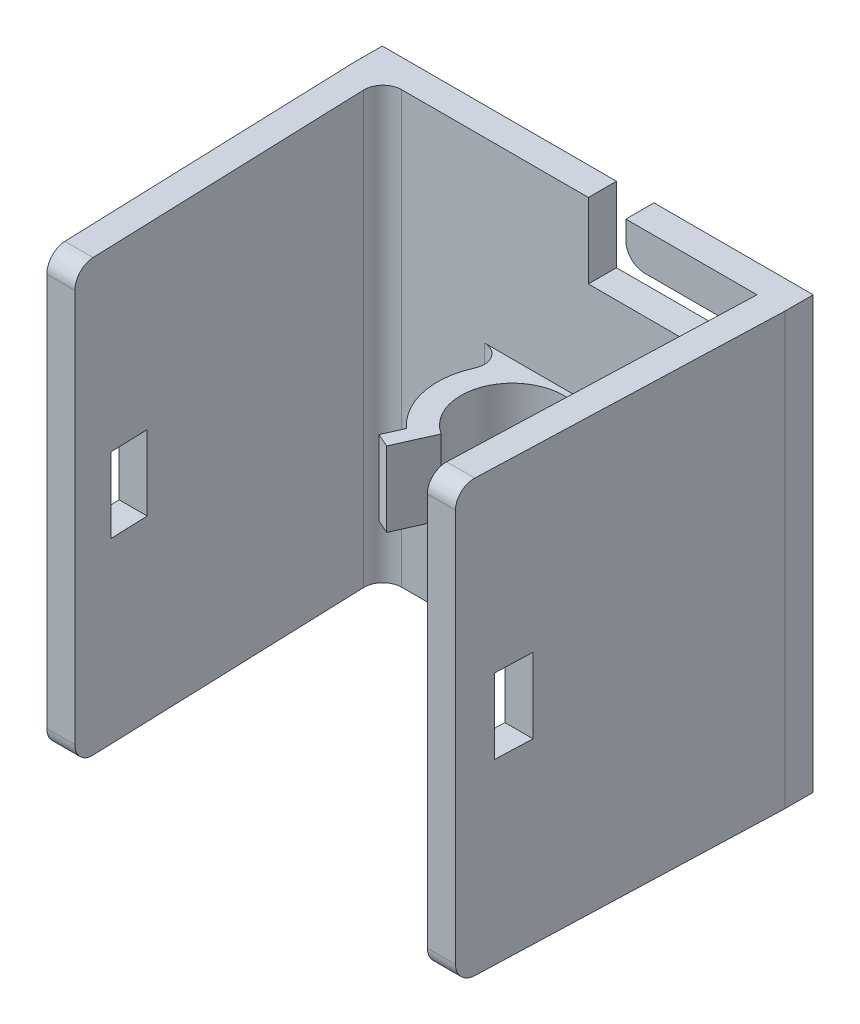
SolidWorks part; units mm, degrees
ref_plane "Plan de face" through (0, 0, 0) normal (0, 0, 1) x (1, 0, 0)
ref_plane "Plan de dessus" through (0, 0, 0) normal (0, 1, 0) x (1, 0, 0)
ref_plane "Plan de droite" through (0, 0, 0) normal (1, 0, 0) x (0, 0, -1)
sketch "Esquisse1" plane through (0, 0, 0) normal (0, 0, 1) x (1, 0, 0)
  line L1 (-24.8932, 11.4129) -> (-1.8932, 11.4129)
  line L2 (-24.8932, 11.4129) -> (-24.8932, -11.5871)
  line L3 (-24.8932, -11.5871) -> (-1.8932, -11.5871)
  line L4 (-1.8932, 11.4129) -> (-1.8932, -11.5871)
  dimension "D1" = 23
  dimension "D2" = 23
extrude "Boss.-Extru.1" add sketch "Esquisse1" along normal blind 1.5
sketch "Esquisse2" plane through (0, -11.5871, 0) normal (0, -1, 0) x (1, 0, 0)
  line L0 (-24.8932, 1.5) -> (-24.2996, 18.5)
  line L1 (-24.2996, 18.5) -> (-22.7996, 18.5)
  line L2 (-22.7996, 18.5) -> (-23.3932, 1.5)
  line L3 (-24.8932, 1.5) -> (-1.8932, 1.5) construction
  line L4 (-23.3932, 1.5) -> (-24.8932, 1.5)
  line L5 (-13.3932, 1.5) -> (-13.3932, 31.4427) construction
  line L6 (-3.3932, 1.5) -> (-1.8932, 1.5)
  line L7 (-3.9869, 18.5) -> (-3.3932, 1.5)
  line L8 (-2.4869, 18.5) -> (-3.9869, 18.5)
  line L9 (-1.8932, 1.5) -> (-2.4869, 18.5)
  dimension "D1" = 1.5
  dimension "D2" = 88
  dimension "D3" = 17
extrude "Boss.-Extru.2" add sketch "Esquisse2" against normal blind 23
sketch "Esquisse3" plane through (0, 0, 0) normal (1, 0, 0) x (0, 0, -1)
  line L0 (-1.5, -0.0871) -> (-22.1057, -0.0871) construction
  line L1 (-16.5, 1.9129) -> (-14.5, 1.9129)
  line L2 (-16.5, 1.9129) -> (-16.5, -2.0871)
  line L3 (-16.5, -2.0871) -> (-14.5, -2.0871)
  line L4 (-14.5, 1.9129) -> (-14.5, -2.0871)
  line L5 (-1.5, -11.5871) -> (-1.5, 11.4129) construction
  line L6 (-18.5, 11.4129) -> (-18.5, -11.5871) construction
  dimension "D1" = 2
  dimension "D2" = 2
  dimension "D3" = 2
  dimension "D4" = 2
extrude "Enlèv. mat.-Extru.1" cut sketch "Esquisse3" against normal through all both and the other way through all
ref_plane "Plan1" through (-13.3932, 0, 0) normal (-1, 0, 0) x (0, 0, 1)
ref_plane "Plan2" through (0, -0.0871, 0) normal (0, 1, 0) x (1, 0, 0)
sketch "Esquisse6" plane through (0, -0.0871, 0) normal (0, 1, 0) x (1, 0, 0)
  line L0 (-13.3932, 0) -> (-13.3932, -14.3157) construction
  line L2 (-1.8932, 0) -> (-24.8932, 0) construction
  line L3 (-13.3932, 0.825) -> (-13.3932, -0.825) construction
  circle A0 centre (-13.3932, -4.5572) radius 4
  circle A1 centre (-13.3932, -4.5572) radius 2.75
  point P8 (-13.3932, -4.5572)
  dimension "D1" = 8
  dimension "D2" = 5.5
extrude "Boss.-Extru.3" add sketch "Esquisse6" along normal mid plane 4
fillet "Congé1" radius 1 2 edges at (-15.9726, -0.0871, 1.5) (-10.8138, -0.0871, 1.5)
sketch "Esquisse7" plane through (0, 1.9129, 0) normal (0, 1, 0) x (1, 0, 0)
  line L0 (-13.3932, -0.4217) -> (-13.3932, -11.0335) construction
  line L6 (-13.3932, 0.825) -> (-13.3932, -0.825) construction
  line L7 (-13.3932, -3.5093) -> (-10.0292, -11.0335)
  line L8 (-10.0292, -11.0335) -> (-16.7572, -11.0335)
  line L9 (-13.3932, -3.5093) -> (-16.7572, -11.0335)
  point P7 (0, 0)
  point P8 (0, 0)
  point P10 (-13.3932, -5.3978)
  point P11 (-13.3932, -3.5093)
  point P12 (-10.0292, -11.0335)
extrude "Enlèv. mat.-Extru.2" cut sketch "Esquisse7" against normal through all both and the other way through all
sketch "Esquisse8" plane through (0, 1.9129, 0) normal (0, 1, 0) x (1, 0, 0)
  line L0 (-14.8925, -6.8626) -> (-15.7904, -8.871)
  line L1 (-13.3932, -0.9613) -> (-13.3932, -13.4616) construction
  line L2 (-13.3932, 0.825) -> (-13.3932, -0.825) construction
  line L3 (-14.8925, -6.8626) -> (-15.407, -8.0134) construction
  line L4 (-15.7904, -8.871) -> (-16.518, -8.5457)
  line L5 (-16.518, -8.5457) -> (-15.6201, -6.5373)
  line L6 (-15.6201, -6.5373) -> (-14.8925, -6.8626)
  line L7 (-11.1664, -6.5373) -> (-11.894, -6.8626)
  line L8 (-10.2685, -8.5457) -> (-11.1664, -6.5373)
  line L9 (-10.9961, -8.871) -> (-10.2685, -8.5457)
  line L10 (-11.894, -6.8626) -> (-10.9961, -8.871)
  dimension "D1" = 2.2
extrude "Boss.-Extru.4" add sketch "Esquisse8" against normal blind 4
sketch "Esquisse9" plane through (0, 0, 0) normal (0, 0, -1) x (-1, 0, 0)
  line L0 (1.8932, -11.5871) -> (1.8932, 11.4129) construction
  line L1 (3.3932, 9.4129) -> (12.3932, 9.4129)
  line L2 (3.3932, 9.4129) -> (3.3932, 7.4129)
  line L3 (3.3932, 7.4129) -> (12.3932, 7.4129)
  line L4 (12.3932, 9.4129) -> (12.3932, 7.4129)
  line L5 (1.8932, 11.4129) -> (24.8932, 11.4129) construction
  dimension "D1" = 1.5
  dimension "D2" = 2
  dimension "D3" = 2
  dimension "D4" = 9
extrude "Enlèv. mat.-Extru.3" cut sketch "Esquisse9" against normal blind 4
sketch "Esquisse10" plane through (0, 0, 0) normal (0, 0, -1) x (-1, 0, 0)
  line L0 (1.8932, 11.4129) -> (24.8932, 11.4129) construction
  line L1 (10.3932, 9.4129) -> (12.3932, 9.4129)
  line L2 (10.3932, 9.4129) -> (10.3932, 11.4129)
  line L3 (10.3932, 11.4129) -> (12.3932, 11.4129)
  line L4 (12.3932, 9.4129) -> (12.3932, 11.4129)
  line L5 (12.3932, 9.4129) -> (3.3932, 9.4129) construction
  line L6 (12.3932, 7.4129) -> (12.3932, 9.4129) construction
  point P7 (5.3932, 9.4129)
  point P8 (0, 0)
  point P9 (0, 0)
  point P10 (0, 0)
  point P11 (8.6512, 9.4129)
  point P14 (12.3932, 9.4129)
  dimension "D1" = 2
extrude "Enlèv. mat.-Extru.4" cut sketch "Esquisse10" against normal blind 4
fillet "Congé2" radius 1 7 edges at (-23.5496, -11.5871, 18.5) (-3.2369, -11.5871, 18.5) (-23.5496, 11.4129, 18.5) (-3.2369, 11.4129, 18.5) (-3.3932, -2.0871, 1.5) (-23.3932, -0.0871, 1.5) (-10.3932, 9.4129, 0.75)
